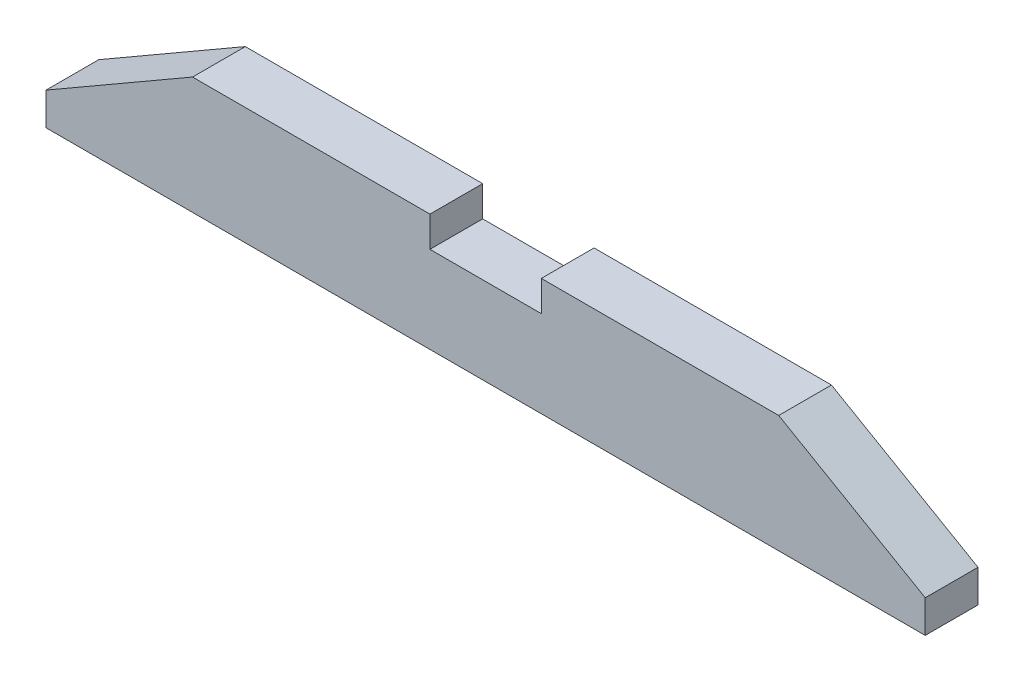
SolidWorks part; units mm, degrees
ref_plane "Plan de face" through (0, 0, 0) normal (0, 0, 1) x (1, 0, 0)
ref_plane "Plan de dessus" through (0, 0, 0) normal (0, 1, 0) x (1, 0, 0)
ref_plane "Plan de droite" through (0, 0, 0) normal (1, 0, 0) x (0, 0, -1)
sketch "Esquisse1" plane through (0, 0, 0) normal (0, 0, 1) x (1, 0, 0)
  line L0 (0, -621.2116) -> (0, -591.6247) construction
  line L2 (-19, -581.2116) -> (-150, -581.2116)
  line L4 (-150, -581.2116) -> (-150, -621.2116)
  line L5 (-150, -621.2116) -> (150, -621.2116)
  line L6 (-19, -581.2116) -> (-19, -591.6247)
  line L7 (-19, -591.6247) -> (19, -591.6247)
  line L8 (19, -581.2116) -> (19, -591.6247)
  line L9 (150, -581.2116) -> (150, -621.2116)
  line L10 (19, -581.2116) -> (150, -581.2116)
  dimension "D1" = 40
  dimension "D2" = 300
extrude "Boss.-Extru.1" add sketch "Esquisse1" along normal blind 18
chamfer "Chanfrein1" distance 50 angle 30 1 edges at (-150, -581.2116, 9)
chamfer "Chanfrein2" distance 50 angle 30 1 edges at (150, -581.2116, 9)
